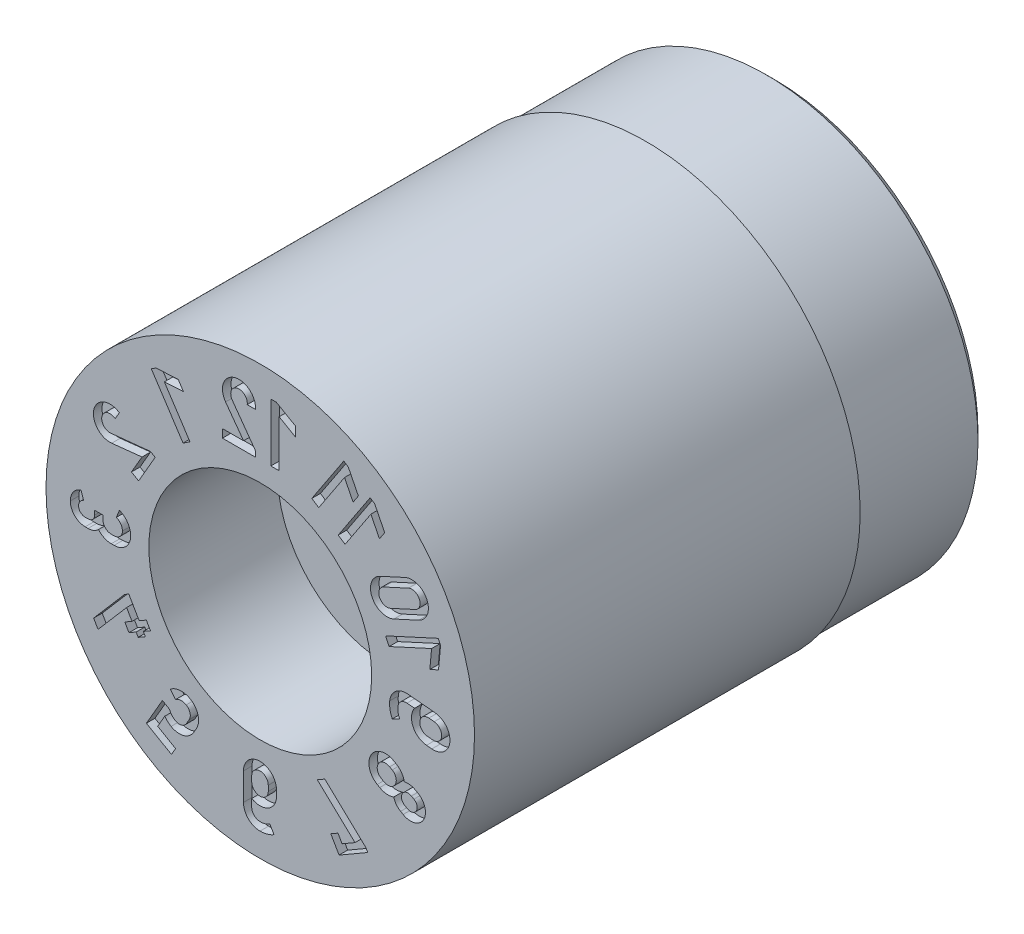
SolidWorks part; units mm, degrees
ref_plane "Front Plane" through (0, 0, 0) normal (0, 0, 1) x (1, 0, 0)
ref_plane "Top Plane" through (0, 0, 0) normal (0, 1, 0) x (1, 0, 0)
ref_plane "Right Plane" through (0, 0, 0) normal (1, 0, 0) x (0, 0, -1)
sketch "Sketch1" plane through (0, 0, 0) normal (1, 0, 0) x (0, 0, -1)
  line L2 (0, 5) -> (0, 2.6)
  line L3 (11.75, 5) -> (0, 5)
  line L4 (-3.7979, 0) -> (49996.2021, 0) construction
  line L8 (12, 1.25) -> (3, 1.25)
  line L9 (3, 2.6) -> (3, 1.25)
  line L10 (3, 2.6) -> (0, 2.6)
  line L12 (12, 1.25) -> (12, 4.75)
  line L16 (12, 4.75) -> (11.75, 5)
  dimension "D1" = 12
  dimension "D2" = 45
  dimension "D3" = 0.25
  dimension "D4" = 10
  dimension "D5" = 5.2
  dimension "D6" = 3
  dimension "D7" = 2.5
revolve "Revolve1" add sketch "Sketch1" angle 360 about L4
sketch "Sketch4" plane through (0, 0, 0) normal (1, 0, 0) x (0, 0, -1)
  line L0 (0, 0) -> (50000, 0) construction
  line L1 (12, -4.75) -> (12, 4.75) construction
  line L2 (9, 5.935) -> (12, 5.935)
  line L3 (9, 5.935) -> (9, 4.935)
  line L4 (9, 4.935) -> (12, 4.935)
  line L5 (12, 5.935) -> (12, 4.935)
  line L6 (11.75, 5) -> (0, 5) construction
  line L9 (0, 5.5) -> (0, -5.5) construction
  dimension "D1" = 1
  dimension "D2" = 0.065
  dimension "D3" = 9
revolve "Cut-Revolve1" cut sketch "Sketch4" angle 360 about L0
sketch "Sketch2" plane through (0, 0, 0) normal (0, 0, 1) x (1, 0, 0)
  line L575 (2.5646, 3.579) -> (2.6706, 3.5089)
  line L576 (2.6706, 3.5089) -> (2.9045, 3.0425)
  line L577 (2.9045, 3.0425) -> (2.7817, 2.8567)
  line L578 (2.7817, 2.8567) -> (2.5819, 3.2549)
  line L579 (2.5819, 3.2549) -> (1.9802, 2.3446)
  line L580 (1.9802, 2.3446) -> (1.8191, 2.451)
  line L581 (1.8191, 2.451) -> (2.5646, 3.579)
  line L582 (1.9495, 4.0128) -> (2.0556, 3.9427)
  line L583 (2.0556, 3.9427) -> (2.2895, 3.4763)
  line L584 (2.2895, 3.4763) -> (2.1667, 3.2905)
  line L585 (2.1667, 3.2905) -> (1.9668, 3.6887)
  line L586 (1.9668, 3.6887) -> (1.3651, 2.7784)
  line L587 (1.3651, 2.7784) -> (1.204, 2.8849)
  line L588 (1.204, 2.8849) -> (1.9495, 4.0128)
  line L589 (3.0392, 1.5807) -> (3.6184, 1.8467)
  line L590 (3.4571, 2.1978) -> (2.8779, 1.9318)
  line L591 (4.0584, -0.2011) -> (3.9335, -0.1895)
  line L592 (3.8976, -0.5741) -> (4.0225, -0.5857)
  line L593 (4.0764, -0.0087) -> (3.4418, 0.0504)
  line L594 (3.0814, -0.6337) -> (3.2558, -0.5499)
  line L595 (4.0044, -0.778) -> (3.8796, -0.7668)
  line L596 (3.6003, -0.1584) -> (3.4238, -0.1419)
  line L597 (3.3723, -2.2368) -> (3.4309, -2.2705)
  line L598 (3.5854, -2.0029) -> (3.5269, -1.9691)
  line L599 (1.3309, -2.7385) -> (1.5055, -2.6377)
  line L600 (1.5055, -2.6377) -> (2.4624, -3.5394)
  line L601 (2.4624, -3.5394) -> (2.5087, -3.6196)
  line L602 (2.5087, -3.6196) -> (1.8396, -4.0059)
  line L603 (1.8396, -4.0059) -> (1.6465, -3.6714)
  line L604 (1.6465, -3.6714) -> (1.8138, -3.5748)
  line L605 (1.8138, -3.5748) -> (1.9104, -3.7421)
  line L606 (1.9104, -3.7421) -> (2.2114, -3.5682)
  line L607 (2.2114, -3.5682) -> (1.3309, -2.7385)
  line L608 (2.8261, -1.9659) -> (2.8847, -1.9998)
  line L609 (3.0778, -1.6653) -> (3.0193, -1.6314)
  line L610 (3.1744, -1.498) -> (3.1159, -1.4641)
  line L611 (2.7296, -2.1332) -> (2.7881, -2.167)
  line L612 (3.2757, -2.404) -> (3.3343, -2.4378)
  line L613 (3.6818, -1.8357) -> (3.6234, -1.8018)
  line L614 (4.1546, 1.532) -> (4.2077, 1.4165)
  line L615 (4.2077, 1.4165) -> (4.1601, 0.8969)
  line L616 (4.1601, 0.8969) -> (3.9577, 0.804)
  line L617 (3.9577, 0.804) -> (3.9983, 1.2477)
  line L618 (3.9983, 1.2477) -> (3.0066, 0.7922)
  line L619 (3.0066, 0.7922) -> (2.926, 0.9677)
  line L620 (2.926, 0.9677) -> (4.1546, 1.532)
  line L621 (3.3765, 2.3734) -> (2.7973, 2.1073)
  line L622 (3.1198, 1.4051) -> (3.699, 1.6712)
  line L623 (0.2473, 4.4142) -> (0.3744, 4.4142)
  line L624 (0.3744, 4.4142) -> (0.8267, 4.1541)
  line L625 (0.8267, 4.1541) -> (0.8267, 3.9314)
  line L626 (0.8267, 3.9314) -> (0.4404, 4.1534)
  line L627 (0.4404, 4.1534) -> (0.4404, 3.0622)
  line L628 (0.4404, 3.0622) -> (0.2473, 3.0622)
  line L629 (0.2473, 3.0622) -> (0.2473, 4.4142)
  line L630 (-0.882, 3.0592) -> (-0.1094, 3.0592)
  line L631 (-0.1094, 3.0592) -> (-0.1094, 3.187)
  line L632 (-0.1094, 3.187) -> (-0.6525, 3.941)
  line L633 (-0.3047, 4.0249) -> (-0.1105, 4.0249)
  line L634 (-0.8095, 3.8279) -> (-0.3894, 3.2524)
  line L635 (-0.3894, 3.2524) -> (-0.882, 3.2524)
  line L636 (-0.882, 3.2524) -> (-0.882, 3.0592)
  line L637 (-2.5418, 3.6315) -> (-2.4355, 3.7012)
  line L638 (-2.4355, 3.7012) -> (-1.9146, 3.7313)
  line L639 (-1.9146, 3.7313) -> (-1.7926, 3.5449)
  line L640 (-1.7926, 3.5449) -> (-2.2374, 3.5191)
  line L641 (-2.2374, 3.5191) -> (-1.6398, 2.6061)
  line L642 (-1.6398, 2.6061) -> (-1.8014, 2.5003)
  line L643 (-1.8014, 2.5003) -> (-2.5418, 3.6315)
  line L644 (-0.1992, -3.4205) -> (-0.1992, -3.546)
  line L645 (0.1871, -3.546) -> (0.1871, -3.4205)
  line L646 (0.3801, -3.4207) -> (0.3806, -3.546)
  line L647 (-0.1992, -3.8806) -> (-0.1992, -4.0579)
  line L648 (-0.3925, -3.4205) -> (-0.3924, -4.0579)
  line L649 (0.3223, -4.3531) -> (0.2226, -4.1872)
  line L650 (-2.2287, -3.234) -> (-2.3937, -3.5197)
  line L651 (-2.3937, -3.5197) -> (-1.9755, -3.7612)
  line L652 (-1.9755, -3.7612) -> (-2.0721, -3.9285)
  line L653 (-2.0721, -3.9285) -> (-2.6575, -3.5905)
  line L654 (-2.6575, -3.5905) -> (-2.2826, -2.9412)
  line L655 (-2.2826, -2.9412) -> (-2.1154, -3.0377)
  line L656 (-1.7212, -3.1275) -> (-1.6584, -3.0188)
  line L657 (-1.9783, -2.7734) -> (-2.0986, -2.622)
  line L658 (-1.4911, -3.1153) -> (-1.554, -3.2239)
  line L659 (-3.41, -0.179) -> (-3.4776, -0.179)
  line L660 (-3.6707, 0.0141) -> (-3.6707, 0.1106)
  line L661 (-3.6707, 0.1106) -> (-3.8638, 0.1106)
  line L662 (-3.8638, 0.1106) -> (-3.8638, 0.0141)
  line L663 (-4.0183, -0.1404) -> (-4.0859, -0.1404)
  line L664 (-4.1223, 0.1788) -> (-4.1841, 0.3618)
  line L665 (-4.0859, -0.3336) -> (-4.0183, -0.3336)
  line L666 (-3.4776, -0.3722) -> (-3.4099, -0.3722)
  line L667 (-3.2866, 0.4004) -> (-3.3574, 0.2208)
  line L668 (-3.8881, -2.0806) -> (-3.7858, -2.2577)
  line L669 (-3.7858, -2.2577) -> (-3.1184, -1.4822)
  line L670 (-3.1184, -1.4822) -> (-2.9933, -1.6989)
  line L671 (-2.9933, -1.6989) -> (-3.1606, -1.7954)
  line L672 (-3.1606, -1.7954) -> (-3.064, -1.9627)
  line L673 (-3.064, -1.9627) -> (-2.8968, -1.8661)
  line L674 (-2.8968, -1.8661) -> (-2.8485, -1.9498)
  line L675 (-2.8485, -1.9498) -> (-2.6812, -1.8532)
  line L676 (-2.6812, -1.8532) -> (-2.7295, -1.7696)
  line L677 (-2.7295, -1.7696) -> (-2.5622, -1.673)
  line L678 (-2.5622, -1.673) -> (-2.6588, -1.5057)
  line L679 (-2.6588, -1.5057) -> (-2.8261, -1.6023)
  line L680 (-2.8261, -1.6023) -> (-3.0675, -1.1841)
  line L681 (-3.0675, -1.1841) -> (-3.1653, -1.2406)
  line L682 (-3.1653, -1.2406) -> (-3.8881, -2.0806)
  line L683 (-3.0056, 1.3141) -> (-2.8383, 1.2175)
  line L684 (-2.8383, 1.2175) -> (-2.452, 1.8866)
  line L685 (-2.452, 1.8866) -> (-2.5626, 1.9504)
  line L686 (-2.5626, 1.9504) -> (-3.4872, 1.8571)
  line L687 (-3.386, 2.2002) -> (-3.2888, 2.3685)
  line L688 (-3.4678, 1.6646) -> (-2.7593, 1.7406)
  line L689 (-2.7593, 1.7406) -> (-3.0056, 1.3141)
  arc A270 (2.8779, 1.9318) -> (3.0392, 1.5807) centre (2.9585, 1.7562) ccw
  arc A271 (3.6184, 1.8467) -> (3.4571, 2.1978) centre (3.5378, 2.0223) ccw
  arc A272 (3.9335, -0.1895) -> (3.8976, -0.5741) centre (3.9155, -0.3818) ccw
  arc A273 (4.0225, -0.5857) -> (4.0584, -0.2011) centre (4.0405, -0.3934) ccw
  arc A274 (3.4418, 0.0504) -> (3.0212, -0.2983) centre (3.4059, -0.3343) ccw
  arc A275 (3.0212, -0.2983) -> (3.0814, -0.6337) centre (3.6553, -0.3577) ccw
  arc A276 (4.0044, -0.778) -> (4.0764, -0.0087) centre (4.0404, -0.3933) ccw
  arc A277 (3.6003, -0.1584) -> (3.8796, -0.7668) centre (3.9141, -0.3826) ccw
  arc A278 (3.4238, -0.1419) -> (3.2155, -0.3016) centre (3.4058, -0.3342) ccw
  arc A279 (3.2155, -0.3016) -> (3.2558, -0.5499) centre (3.5976, -0.367) ccw
  arc A280 (3.5269, -1.9691) -> (3.3723, -2.2368) centre (3.4494, -2.1028) ccw
  arc A281 (3.4309, -2.2705) -> (3.5854, -2.0029) centre (3.5081, -2.1367) ccw
  arc A282 (3.0193, -1.6314) -> (2.8261, -1.9659) centre (2.9228, -1.7987) ccw
  arc A283 (2.8847, -1.9998) -> (3.0778, -1.6653) centre (2.9812, -1.8325) ccw
  arc A284 (3.3618, -1.7665) -> (3.1744, -1.498) centre (2.9812, -1.8325) ccw
  arc A285 (3.1159, -1.4641) -> (2.7296, -2.1332) centre (2.9224, -1.7985) ccw
  arc A286 (2.7881, -2.167) -> (3.1143, -2.1951) centre (2.9812, -1.8325) ccw
  arc A287 (3.1143, -2.1951) -> (3.2757, -2.404) centre (3.45, -2.1026) ccw
  arc A288 (3.3343, -2.4378) -> (3.6818, -1.8357) centre (3.5081, -2.1368) ccw
  arc A289 (3.6234, -1.8018) -> (3.3618, -1.7665) centre (3.45, -2.0999) ccw
  arc A290 (2.7973, 2.1073) -> (3.1198, 1.4051) centre (2.9585, 1.7562) ccw
  arc A291 (3.699, 1.6712) -> (3.3765, 2.3734) centre (3.5378, 2.0223) ccw
  arc A292 (-0.3047, 4.0249) -> (-0.6525, 3.941) centre (-0.4958, 4.0539) ccw
  arc A293 (-0.1105, 4.0249) -> (-0.8095, 3.8279) centre (-0.4959, 4.0537) ccw
  arc A294 (-0.1992, -3.546) -> (0.1871, -3.546) centre (-0.0061, -3.546) ccw
  arc A295 (0.1871, -3.4205) -> (-0.1992, -3.4205) centre (-0.0061, -3.4205) ccw
  arc A296 (0.3801, -3.4207) -> (-0.3925, -3.4205) centre (-0.0062, -3.4206) ccw
  arc A297 (-0.1992, -3.8806) -> (0.3806, -3.546) centre (-0.0051, -3.5473) ccw
  arc A298 (-0.1992, -4.0579) -> (-0.0209, -4.2504) centre (-0.0061, -4.0579) ccw
  arc A299 (-0.0209, -4.2504) -> (0.2226, -4.1872) centre (0.0087, -3.8639) ccw
  arc A300 (-0.3924, -4.0579) -> (-0.0061, -4.4442) centre (-0.006, -4.0578) ccw
  arc A301 (-0.0061, -4.4442) -> (0.3223, -4.3531) centre (-0.0059, -3.8073) ccw
  arc A302 (-2.1154, -3.0377) -> (-1.985, -3.1982) centre (-1.84, -2.9471) ccw
  arc A303 (-1.985, -3.1982) -> (-1.7212, -3.1275) centre (-1.8884, -3.031) ccw
  arc A304 (-1.6584, -3.0188) -> (-1.7291, -2.7549) centre (-1.8255, -2.9222) ccw
  arc A305 (-1.7291, -2.7549) -> (-1.9783, -2.7734) centre (-1.8401, -2.9475) ccw
  arc A306 (-1.6325, -2.5876) -> (-2.0986, -2.622) centre (-1.8403, -2.9469) ccw
  arc A307 (-1.4911, -3.1153) -> (-1.6325, -2.5876) centre (-1.8261, -2.9223) ccw
  arc A308 (-2.0816, -3.3654) -> (-1.554, -3.2239) centre (-1.8888, -3.0301) ccw
  arc A309 (-2.2287, -3.234) -> (-2.0816, -3.3654) centre (-1.8429, -2.9503) ccw
  arc A310 (-3.2168, 0.0141) -> (-3.3574, 0.2208) centre (-3.439, 0.0141) ccw
  arc A311 (-3.41, -0.179) -> (-3.2168, 0.0141) centre (-3.41, 0.0141) ccw
  arc A312 (-3.6707, 0.0141) -> (-3.4776, -0.179) centre (-3.4776, 0.0141) ccw
  arc A313 (-4.0183, -0.1404) -> (-3.8638, 0.0141) centre (-4.0183, 0.0141) ccw
  arc A314 (-4.2405, 0.0141) -> (-4.0859, -0.1404) centre (-4.0858, 0.0142) ccw
  arc A315 (-4.1223, 0.1788) -> (-4.2405, 0.0141) centre (-4.0669, 0.0143) ccw
  arc A316 (-4.1841, 0.3618) -> (-4.4336, 0.0141) centre (-4.0665, 0.014) ccw
  arc A317 (-4.4336, 0.0141) -> (-4.0859, -0.3336) centre (-4.086, 0.014) ccw
  arc A318 (-4.0183, -0.3336) -> (-3.7742, -0.2334) centre (-4.0183, 0.0139) ccw
  arc A319 (-3.7742, -0.2334) -> (-3.4776, -0.3722) centre (-3.4776, 0.0139) ccw
  arc A320 (-3.4099, -0.3722) -> (-3.0237, 0.0141) centre (-3.4099, 0.014) ccw
  arc A321 (-3.0237, 0.0141) -> (-3.2866, 0.4004) centre (-3.4391, 0.014) ccw
  arc A322 (-3.386, 2.2002) -> (-3.4872, 1.8571) centre (-3.5066, 2.0493) ccw
  arc A323 (-3.2888, 2.3685) -> (-3.4678, 1.6646) centre (-3.5065, 2.0491) ccw
extrude "Cut-Extrude1" cut sketch "Sketch2" against normal blind 0.2
